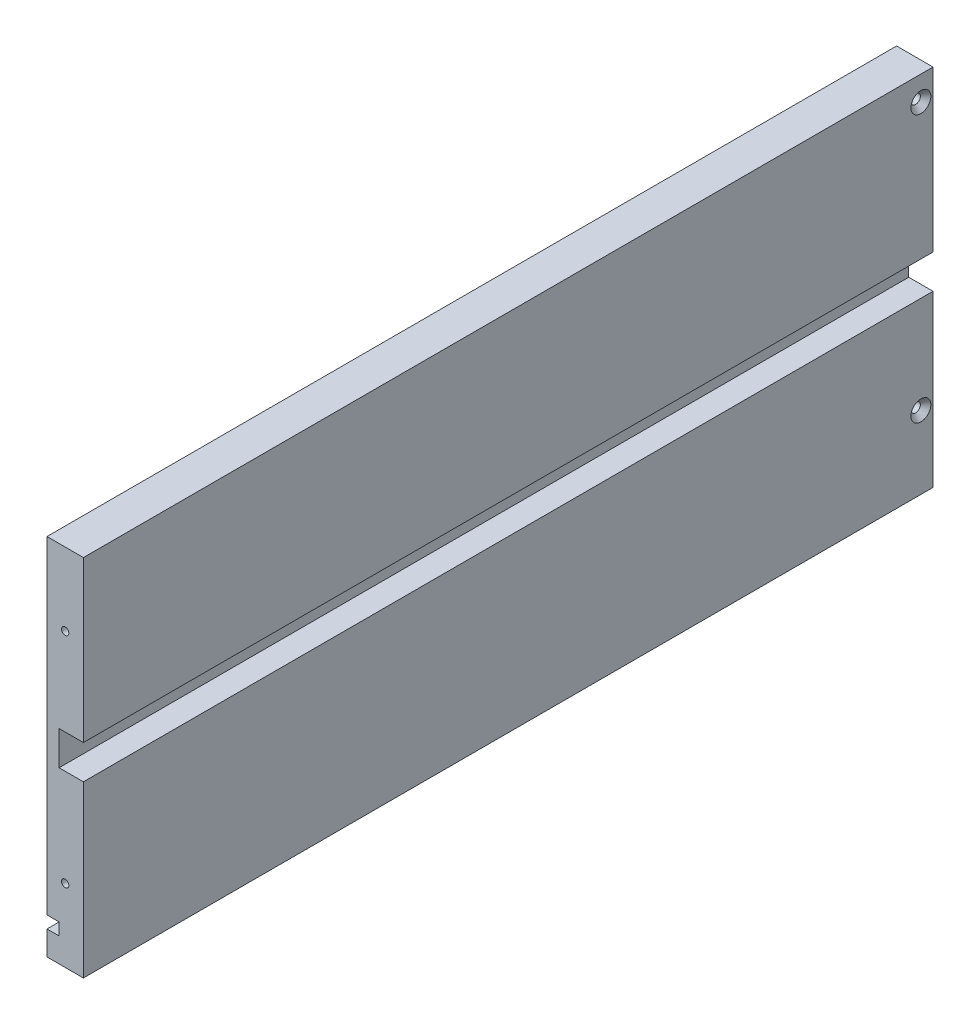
SolidWorks part; units mm, degrees
ref_plane "Front" through (0, 0, 0) normal (0, 0, 1) x (1, 0, 0)
ref_plane "Top" through (0, 0, 0) normal (0, 1, 0) x (1, 0, 0)
ref_plane "Right" through (0, 0, 0) normal (1, 0, 0) x (0, 0, -1)
sketch "Sketch2" plane through (0, 0, 0) normal (1, 0, 0) x (0, 0, -1)
  line L1 (0, 0) -> (350, 0)
  line L2 (0, 0) -> (0, 150)
  line L3 (0, 150) -> (350, 150)
  line L4 (350, 0) -> (350, 150)
  dimension "D1" = 350
  dimension "D2" = 150
extrude "Base-Extrude" add sketch "Sketch2" against normal blind 15
sketch "Sketch3" plane through (0, 0, 0) normal (0, 0, 1) x (1, 0, 0)
  line L0 (0, 150) -> (0, 0) construction
  line L1 (0, 70) -> (-10, 70)
  line L2 (0, 70) -> (0, 84)
  line L3 (0, 84) -> (-10, 84)
  line L4 (-10, 70) -> (-10, 84)
  line L5 (-15, 0) -> (0, 0) construction
  dimension "D1" = 70
  dimension "D2" = 10
  dimension "D3" = 14
extrude "Cut-Extrude1" cut sketch "Sketch3" against normal through all
sketch "Sketch4" plane through (0, 0, 0) normal (0, 0, 1) x (1, 0, 0)
  line L0 (-15, 150) -> (-15, 0) construction
  line L1 (-15, 10) -> (-10, 10)
  line L2 (-15, 10) -> (-15, 15)
  line L3 (-15, 15) -> (-10, 15)
  line L4 (-10, 10) -> (-10, 15)
  line L5 (-15, 0) -> (0, 0) construction
  dimension "D1" = 10
  dimension "D2" = 5
  dimension "D3" = 5
extrude "Cut-Extrude2" cut sketch "Sketch4" against normal through all
hole_wizard "CSK for M3.5 Flat Head Machine Screw1" positions "Sketch7" profile "Sketch6" countersink size "M3.5" standard "Ansi Metric"
sketch "Sketch7" plane through (0, 0, 0) normal (1, 0, 0) x (0, 0, -1)
  line L0 (350, 84) -> (350, 150) construction
  line L1 (350, 150) -> (0, 150) construction
  line L2 (0, 0) -> (350, 0) construction
  point P0 (345, 140)
  point P5 (345, 30)
  dimension "D1" = 5
  dimension "D2" = 10
  dimension "D3" = 30
sketch "Sketch6" plane through (0, 140, -345) normal (0, 1, 0) x (0, 0, -1)
  line L0 (0, 0) -> (0, 15)
  line L1 (0, 15) -> (1.95, 15)
  line L2 (1.95, 15) -> (1.95, 2.15)
  line L3 (1.95, 2.15) -> (4.1, 0)
  line L5 (4.1, 0) -> (0, 0)
  line L6 (-1.95, 2.15) -> (-4.1, 0) construction
  line L11 (0, -6.35) -> (0, 107.95) construction
  dimension "Thru Hole Dia." = 3.9
  dimension "Thru Hole Depth" = 15
  dimension "Near C'Sink Dia." = 8.2
  dimension "Near C'Sink Angle" = 90
hole_wizard "M3.0 (3.000000) Diameter Hole1" positions "Sketch10" profile "Sketch9" hole size "M3.0" standard "Ansi Metric"
sketch "Sketch10" plane through (0, 0, 0) normal (0, 0, 1) x (1, 0, 0)
  line L0 (-7.5, 150) -> (-7.5, 0) construction
  line L1 (-15, 150) -> (0, 150) construction
  line L2 (-15, 0) -> (0, 0) construction
  point P0 (-7.5, 30)
  point P5 (-7.5, 120)
  dimension "D1" = 30
  dimension "D2" = 30
sketch "Sketch9" plane through (-7.5, 30, 0) normal (1, 0, 0) x (0, -1, 0)
  line L0 (0, 0) -> (0, 10.9013)
  line L1 (0, 10.9013) -> (1.5, 10)
  line L2 (1.5, 10) -> (1.5, 0)
  line L5 (1.5, 0) -> (0, 0)
  line L10 (0, 10.9013) -> (-1.5, 10) construction
  line L11 (0, -6.35) -> (0, 107.95) construction
  dimension "Hole Dia." = 3
  dimension "Hole Depth" = 10
  dimension "Drill Angle" = 118
